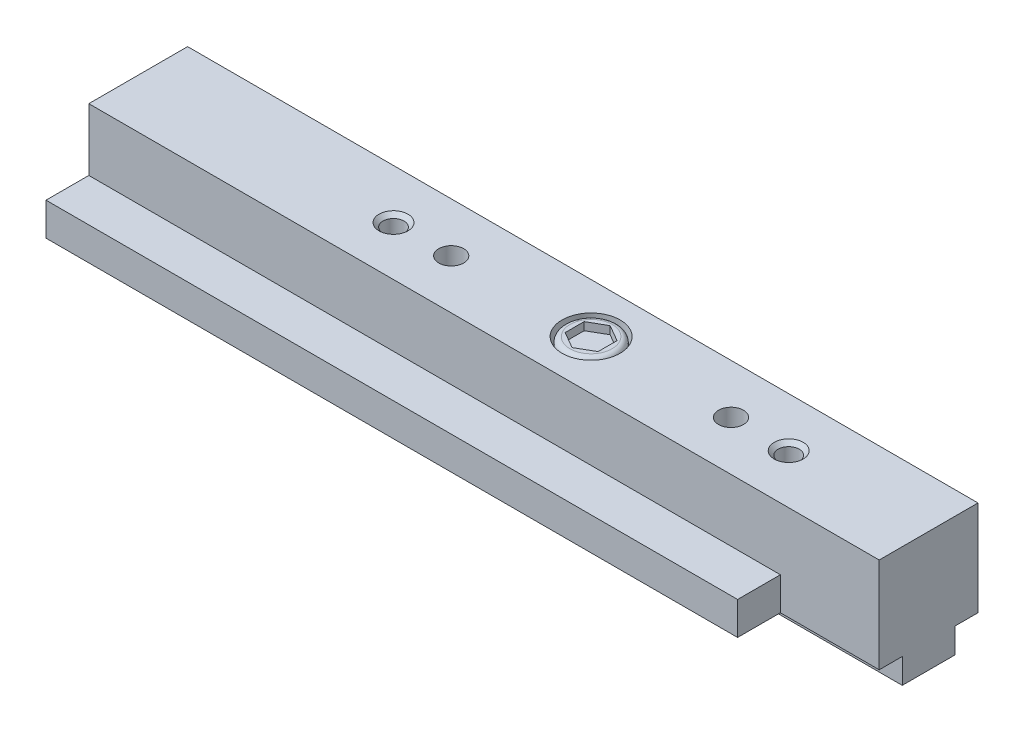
SolidWorks part; units mm, degrees
ref_plane "Front Plane" through (0, 0, 0) normal (0, 0, 1) x (1, 0, 0)
ref_plane "Top Plane" through (0, 0, 0) normal (0, 1, 0) x (1, 0, 0)
ref_plane "Right Plane" through (0, 0, 0) normal (1, 0, 0) x (0, 0, -1)
sketch "Sketch1" plane through (0, 0, 0) normal (1, 0, 0) x (0, 0, -1)
  line L0 (-8.89, 2.413) -> (-2.54, 2.413)
  line L1 (-2.54, 2.413) -> (-2.54, 0)
  line L2 (-2.54, 0) -> (2.54, 0)
  line L3 (2.54, 0) -> (2.54, 2.413)
  line L4 (2.54, 2.413) -> (8.89, 2.413)
  line L5 (8.89, 2.413) -> (8.89, 5.588)
  line L6 (8.89, 5.588) -> (4.7625, 5.588)
  line L7 (4.7625, 5.588) -> (4.7625, 11.5824)
  line L8 (4.7625, 11.5824) -> (-4.7625, 11.5824)
  line L9 (-4.7625, 11.5824) -> (-4.7625, 5.588)
  line L10 (-4.7625, 5.588) -> (-8.89, 5.588)
  line L11 (-8.89, 5.588) -> (-8.89, 2.413)
extrude "Extrude1" add sketch "Sketch1" along normal blind 66.675
ref_plane "Plane1" through (66.675, 0, 0) normal (1, 0, 0) x (0, 0, -1)
sketch "Sketch2" plane through (66.675, 0, 0) normal (1, 0, 0) x (0, 0, -1)
  line L0 (-4.7625, 2.413) -> (-2.54, 2.413)
  line L1 (-2.54, 2.413) -> (-2.54, 0)
  line L2 (-2.54, 0) -> (2.54, 0)
  line L3 (2.54, 0) -> (2.54, 2.413)
  line L4 (2.54, 2.413) -> (4.7625, 2.413)
  line L5 (4.7625, 2.413) -> (4.7625, 11.5824)
  line L6 (4.7625, 11.5824) -> (-4.7625, 11.5824)
  line L7 (-4.7625, 11.5824) -> (-4.7625, 2.413)
extrude "Extrude2" add sketch "Sketch2" along normal blind 9.525
ref_plane "Plane2" through (62.7126, 0, 0) normal (1, 0, 0) x (0, 0, -1)
sketch "Sketch3" plane through (62.7126, 0, 0) normal (1, 0, 0) x (0, 0, -1)
  line L0 (0, 11.5824) -> (1.397, 11.5824)
  line L1 (1.397, 11.5824) -> (1.016, 11.2014)
  line L2 (1.016, 11.2014) -> (1.016, 3.914)
  line L3 (1.016, 3.914) -> (0, 3.3274)
  line L4 (0, 3.3274) -> (0, 11.5824)
  line L5 (0, 3.3274) -> (0, 11.5824) construction
revolve "Cut-Revolve1" cut sketch "Sketch3" angle 360 about L5
ref_plane "Plane3" through (24.6126, 0, 0) normal (1, 0, 0) x (0, 0, -1)
sketch "Sketch4" plane through (24.6126, 0, 0) normal (1, 0, 0) x (0, 0, -1)
  line L0 (0, 11.5824) -> (1.397, 11.5824)
  line L1 (1.397, 11.5824) -> (1.016, 11.2014)
  line L2 (1.016, 11.2014) -> (1.016, 3.914)
  line L3 (1.016, 3.914) -> (0, 3.3274)
  line L4 (0, 3.3274) -> (0, 11.5824)
  line L5 (0, 3.3274) -> (0, 11.5824) construction
revolve "Cut-Revolve2" cut sketch "Sketch4" angle 360 about L5
ref_plane "Plane4" through (0, 11.5824, 0) normal (0, 1, 0) x (-1, 0, 0)
sketch "Sketch5" plane through (0, 11.5824, 0) normal (0, 1, 0) x (-1, 0, 0)
  circle A0 centre (-57.15, 0) radius 1.2027
extrude "Cut-Extrude1" cut sketch "Sketch5" against normal blind 3.048
sketch "Sketch6" plane through (0, 11.5824, 0) normal (0, 1, 0) x (-1, 0, 0)
  circle A0 centre (-30.1752, 0) radius 1.2027
extrude "Cut-Extrude2" cut sketch "Sketch6" against normal blind 3.048
sketch "Sketch7" plane through (0, 11.5824, 0) normal (0, 1, 0) x (-1, 0, 0)
  circle A0 centre (-43.6626, 0) radius 2.794
extrude "Cut-Extrude3" cut sketch "Sketch7" against normal blind 1.524
ref_plane "Plane5" through (43.6626, 0, 0) normal (1, 0, 0) x (0, 0, -1)
sketch "Sketch8" plane through (43.6626, 0, 0) normal (1, 0, 0) x (0, 0, -1)
  line L0 (0, 11.5824) -> (2.032, 11.5824)
  line L1 (2.54, 11.0744) -> (2.54, 10.0584)
  line L2 (2.54, 10.0584) -> (0, 10.0584)
  line L3 (0, 10.0584) -> (0, 11.5824)
  line L4 (0, 10.0584) -> (0, 11.5824) construction
  arc A0 (2.032, 11.5824) -> (2.54, 11.0744) centre (2.032, 11.0744) cw
revolve "Revolve1" add sketch "Sketch8" angle 360 about L4
sketch "Sketch9" plane through (0, 11.5824, 0) normal (0, 1, 0) x (-1, 0, 0)
  line L0 (-42.0751, -0.9165) -> (-42.0751, 0.9165)
  line L1 (-42.0751, 0.9165) -> (-43.6626, 1.8331)
  line L2 (-43.6626, 1.8331) -> (-45.2501, 0.9165)
  line L3 (-45.2501, 0.9165) -> (-45.2501, -0.9165)
  line L4 (-45.2501, -0.9165) -> (-43.6626, -1.8331)
  line L5 (-43.6626, -1.8331) -> (-42.0751, -0.9165)
extrude "Cut-Extrude4" cut sketch "Sketch9" against normal blind 0.762
ref_plane "Plane6" through (76.2, 0, 0) normal (1, 0, 0) x (0, 0, -1)
ref_plane "Plane7" through (49.1998, 0, 0) normal (1, 0, 0) x (0, 0, -1)
